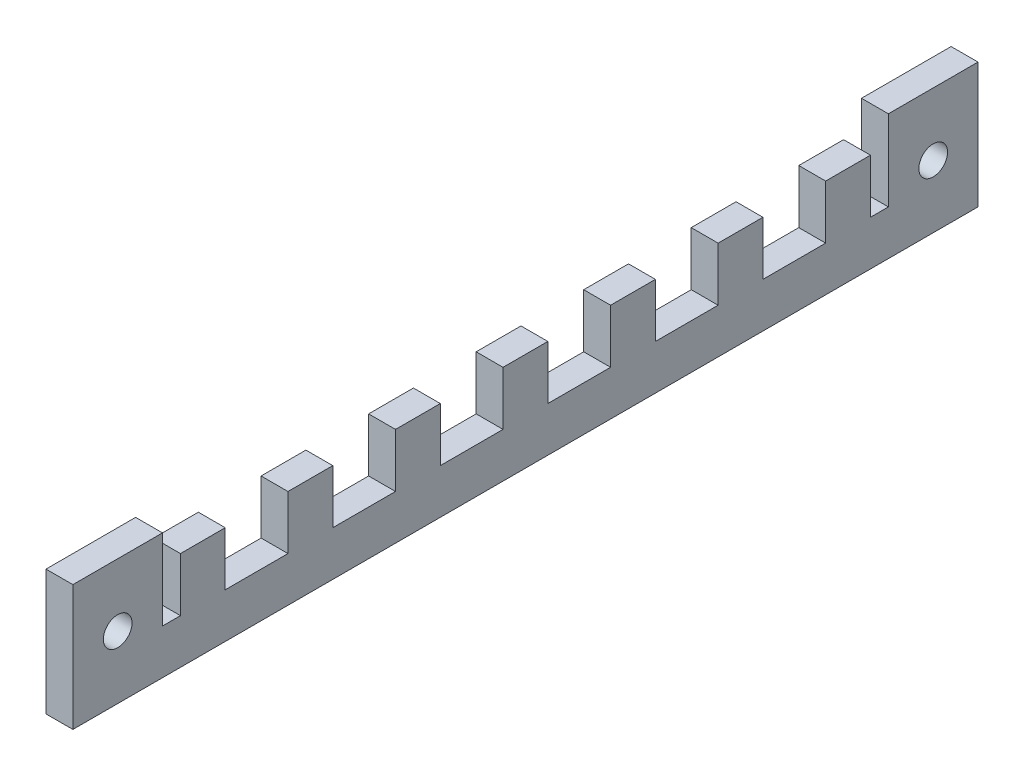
SolidWorks part; units mm, degrees
ref_plane "Front" through (0, 0, 0) normal (0, 0, 1) x (1, 0, 0)
ref_plane "Top" through (0, 0, 0) normal (0, 1, 0) x (1, 0, 0)
ref_plane "Right" through (0, 0, 0) normal (1, 0, 0) x (0, 0, -1)
body saved out of another part "Stock-mold-1"
